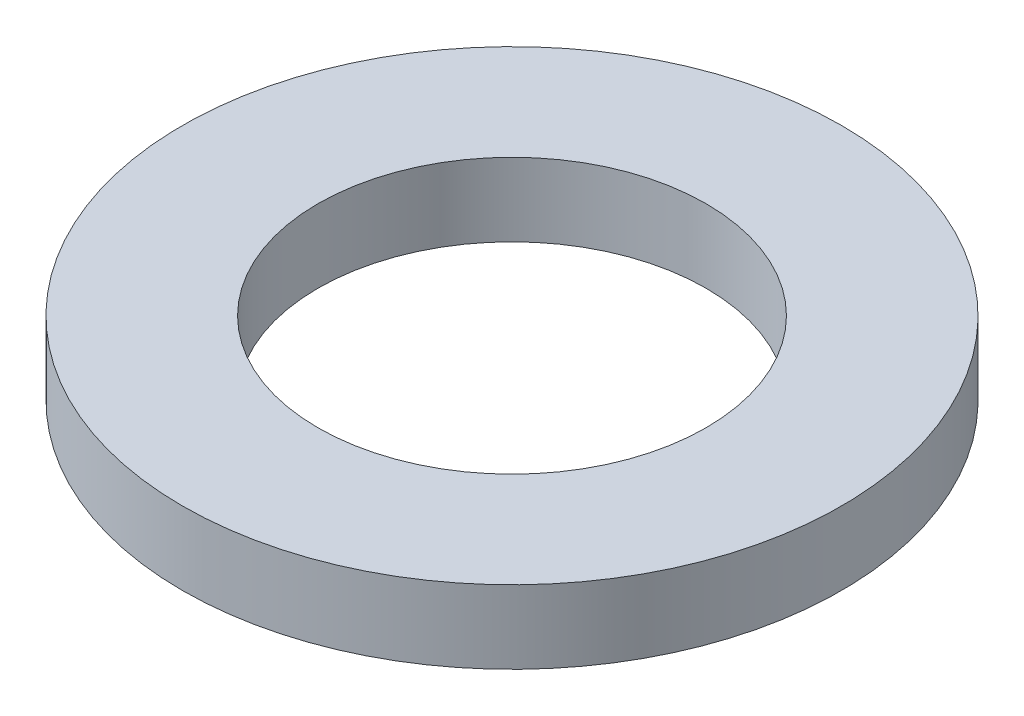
SolidWorks part; units mm, degrees
ref_plane "Aufriss" through (0, 0, 0) normal (0, 0, 1) x (1, 0, 0)
ref_plane "Grundriss" through (0, 0, 0) normal (0, 1, 0) x (1, 0, 0)
ref_plane "Seitenriss" through (0, 0, 0) normal (1, 0, 0) x (0, 0, -1)
sketch "Skizze1" plane through (0, 0, 0) normal (0, 1, 0) x (1, 0, 0)
  circle A0 centre (0, 0) radius 2.65
  circle A1 centre (0, 0) radius 4.5
  dimension "D1" = 5.3
  dimension "D2" = 9
extrude "Aufsatz-Linear austragen1" add sketch "Skizze1" along normal blind 1
